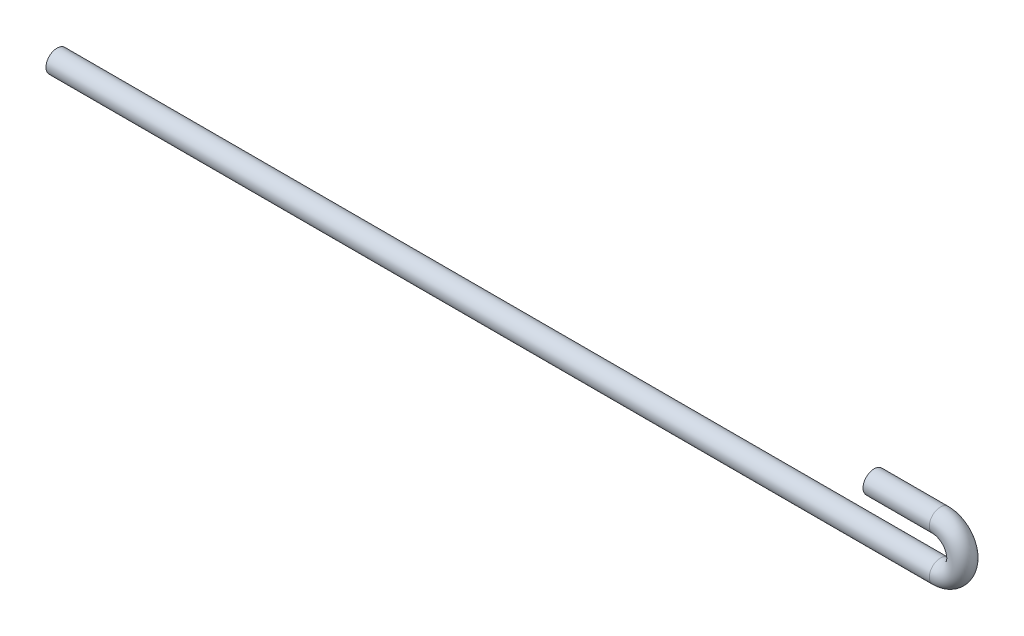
SolidWorks part; units mm, degrees
ref_plane "Plan de face" through (0, 0, 0) normal (0, 0, 1) x (1, 0, 0)
ref_plane "Plan de dessus" through (0, 0, 0) normal (0, 1, 0) x (1, 0, 0)
ref_plane "Plan de droite" through (0, 0, 0) normal (1, 0, 0) x (0, 0, -1)
sketch "Esquisse2" plane through (0, 0, 0) normal (0, 0, 1) x (1, 0, 0)
  line L0 (0, 0) -> (20, 0)
  line L2 (20, 1) -> (18.5, 1)
  arc A0 (20, 0) -> (20, 1) centre (20, 0.5) ccw
sketch "Esquisse3" plane through (0, 0, 0) normal (1, 0, 0) x (0, 0, -1)
  circle A0 centre (0, 0) radius 0.25
sweep "Balayage1" add profiles "Esquisse3" path "Esquisse2"
